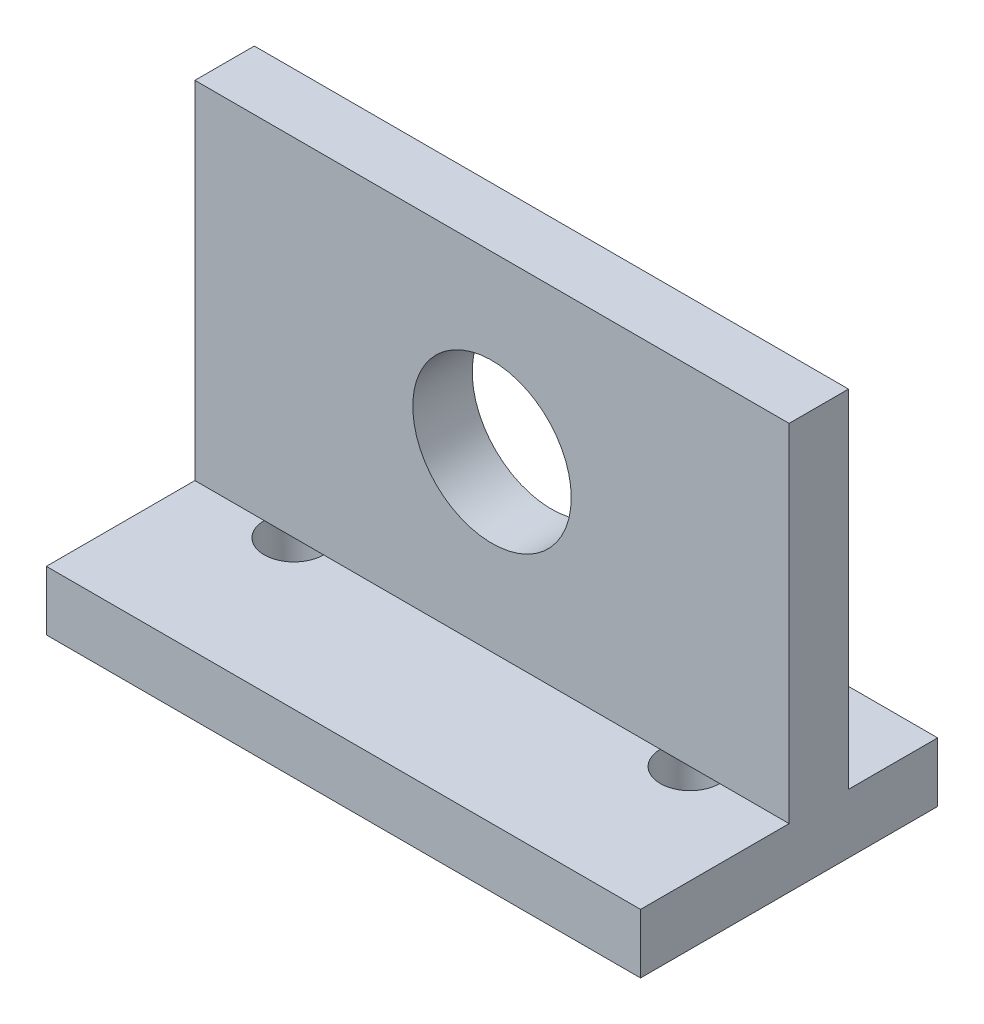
SolidWorks part; units mm, degrees
ref_plane "前视基准面" through (0, 0, 0) normal (0, 0, 1) x (1, 0, 0)
ref_plane "上视基准面" through (0, 0, 0) normal (0, 1, 0) x (1, 0, 0)
ref_plane "右视基准面" through (0, 0, 0) normal (1, 0, 0) x (0, 0, -1)
other "Configuration Table"
sketch "草图1" plane through (0, 0, 0) normal (0, 1, 0) x (1, 0, 0)
  line L1 (-60, -30) -> (60, -30)
  line L2 (-60, -30) -> (-60, 30)
  line L3 (-60, 30) -> (60, 30)
  line L4 (60, -30) -> (60, 30)
  line L5 (-60, -30) -> (60, 30) construction
  line L6 (-60, 30) -> (60, -30) construction
  point P0 (0, 0)
extrude "凸台-拉伸1" add sketch "草图1" against normal blind 12
sketch "草图2" plane through (0, 0, 0) normal (0, 0, 1) x (1, 0, 0)
  line L1 (-60, 0) -> (60, 0)
  line L2 (-60, 0) -> (-60, 70)
  line L3 (-60, 70) -> (60, 70)
  line L4 (60, 0) -> (60, 70)
  line L5 (-60, 0) -> (60, 70) construction
  line L6 (-60, 70) -> (60, 0) construction
  point P0 (0, 35)
extrude "凸台-拉伸2" add sketch "草图2" against normal blind 12
sketch "草图3" plane through (0, 0, 0) normal (0, 1, 0) x (1, 0, 0)
  line L0 (60, 0) -> (-60, 0) construction
  circle A0 centre (40, 0) radius 6
extrude "切除-拉伸1" cut sketch "草图3" against normal blind 12
sketch "草图4" plane through (0, 0, 0) normal (0, 1, 0) x (1, 0, 0)
  line L0 (60, 0) -> (-60, 0) construction
  circle A0 centre (-40, 0) radius 6
extrude "切除-拉伸2" cut sketch "草图4" against normal blind 12
sketch "草图5" plane through (0, 0, 0) normal (0, 0, 1) x (1, 0, 0)
  circle A0 centre (0, 35) radius 16
extrude "切除-拉伸3" cut sketch "草图5" against normal blind 12
